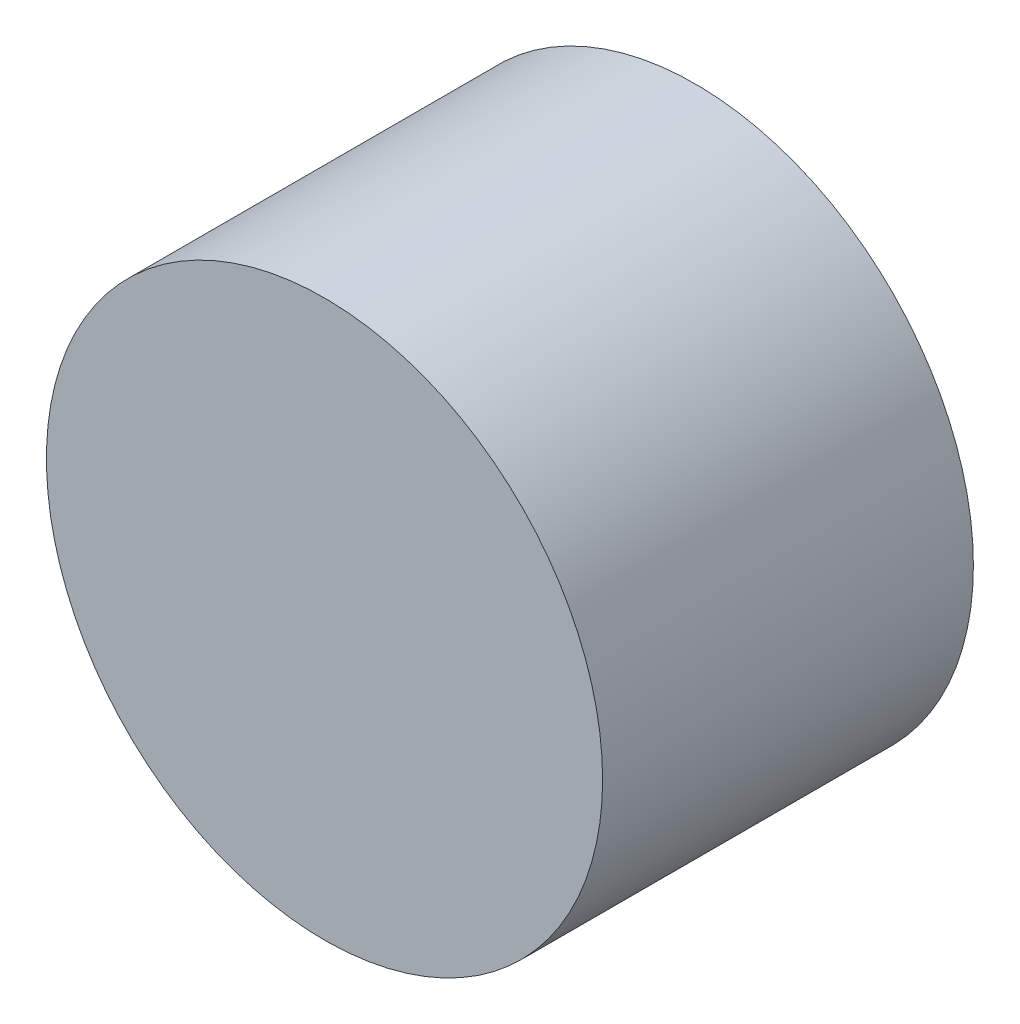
SolidWorks part; units mm, degrees
ref_plane "Plan de face" through (0, 0, 0) normal (0, 0, 1) x (1, 0, 0)
ref_plane "Plan de dessus" through (0, 0, 0) normal (0, 1, 0) x (1, 0, 0)
ref_plane "Plan de droite" through (0, 0, 0) normal (1, 0, 0) x (0, 0, -1)
sketch "Esquisse1" plane through (0, 0, 0) normal (0, 0, 1) x (1, 0, 0)
  circle A0 centre (0, 0) radius 3
  dimension "D1" = 6
extrude "Extrusion1" add sketch "Esquisse1" along normal blind 4
